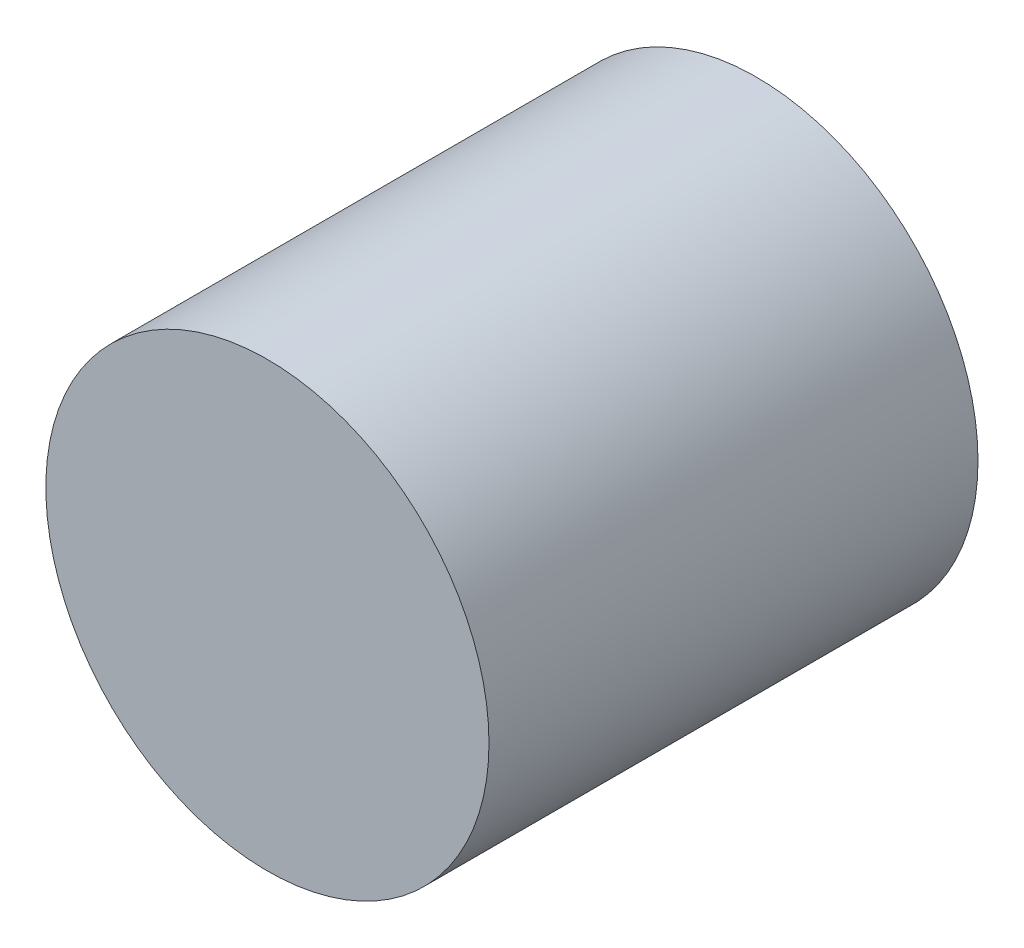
SolidWorks part; units mm, degrees
ref_plane "Face" through (0, 0, 0) normal (0, 0, 1) x (1, 0, 0)
ref_plane "Dessus" through (0, 0, 0) normal (0, 1, 0) x (1, 0, 0)
ref_plane "Droite" through (0, 0, 0) normal (1, 0, 0) x (0, 0, -1)
sketch "Esquisse1" plane through (0, 0, 0) normal (0, 0, 1) x (1, 0, 0)
  circle A0 centre (0, 0) radius 14.5
  dimension "D1" = 29
extrude "Boss.-Extru.1" add sketch "Esquisse1" along normal blind 32
